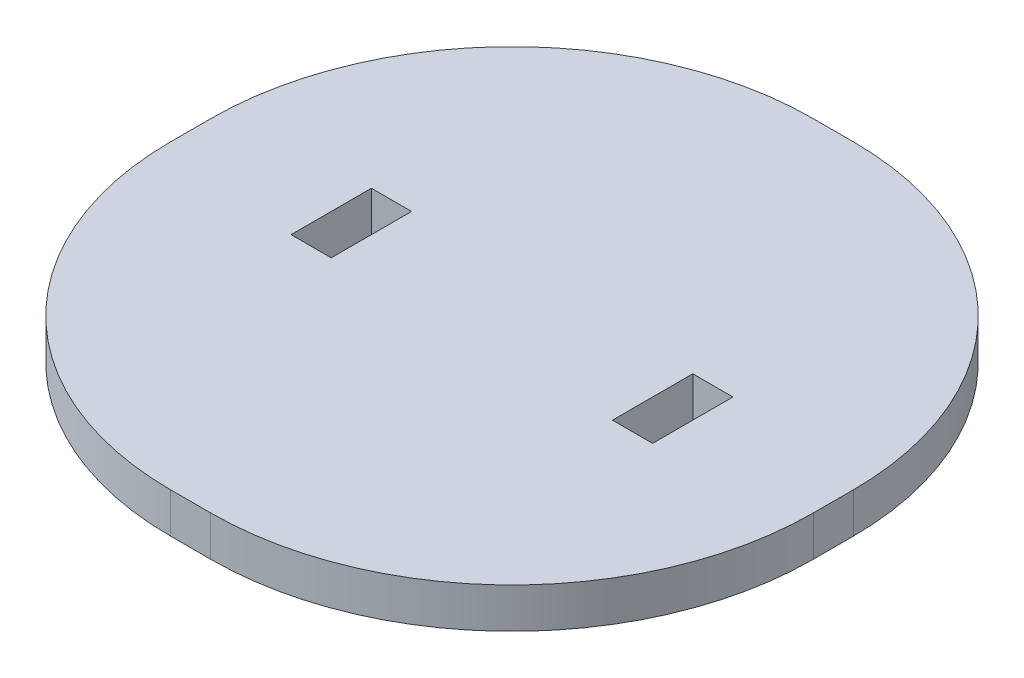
SolidWorks part; units mm, degrees
ref_plane "Front Plane" through (0, 0, 0) normal (0, 0, 1) x (1, 0, 0)
ref_plane "Top Plane" through (0, 0, 0) normal (0, 1, 0) x (1, 0, 0)
ref_plane "Right Plane" through (0, 0, 0) normal (1, 0, 0) x (0, 0, -1)
sketch "Sketch1" plane through (0, 0, 0) normal (0, 1, 0) x (1, 0, 0)
  line L1 (-25.4, 25.4) -> (25.4, 25.4)
  line L2 (-25.4, 25.4) -> (-25.4, -25.4)
  line L3 (-25.4, -25.4) -> (25.4, -25.4)
  line L4 (25.4, 25.4) -> (25.4, -25.4)
  line L5 (-25.4, 25.4) -> (25.4, -25.4) construction
  line L6 (-25.4, -25.4) -> (25.4, 25.4) construction
  point P0 (0, 0)
  dimension "D1" = 50.8
  dimension "D2" = 50.8
extrude "Boss-Extrude1" add sketch "Sketch1" along normal mid plane 3.175
sketch "Sketch2" plane through (0, 1.5875, 0) normal (0, 1, 0) x (1, 0, 0)
  line L0 (0, 26.8431) -> (0, -27.474) construction
  line L1 (14.2875, -3.175) -> (11.1125, 3.175) construction
  line L2 (-14.2875, 3.175) -> (-11.1125, 3.175)
  line L3 (-14.2875, 3.175) -> (-14.2875, -3.175)
  line L4 (-14.2875, -3.175) -> (-11.1125, -3.175)
  line L5 (-11.1125, 3.175) -> (-11.1125, -3.175)
  line L6 (-14.2875, 3.175) -> (-11.1125, -3.175) construction
  line L7 (-14.2875, -3.175) -> (-11.1125, 3.175) construction
  line L8 (14.2875, 3.175) -> (11.1125, -3.175) construction
  line L9 (11.1125, 3.175) -> (11.1125, -3.175)
  line L10 (14.2875, -3.175) -> (11.1125, -3.175)
  line L11 (14.2875, 3.175) -> (14.2875, -3.175)
  line L12 (14.2875, 3.175) -> (11.1125, 3.175)
  point P3 (-12.7, 0)
  point P12 (12.7, 0)
  dimension "D1" = 6.35
  dimension "D2" = 3.175
  dimension "D3" = 12.7
extrude "Cut-Extrude1" cut sketch "Sketch2" against normal through all
fillet "Fillet1" radius 23.8125 4 edges at (25.4, 0, -25.4) (25.4, 0, 25.4) (-25.4, 0, 25.4) (-25.4, 0, -25.4)
